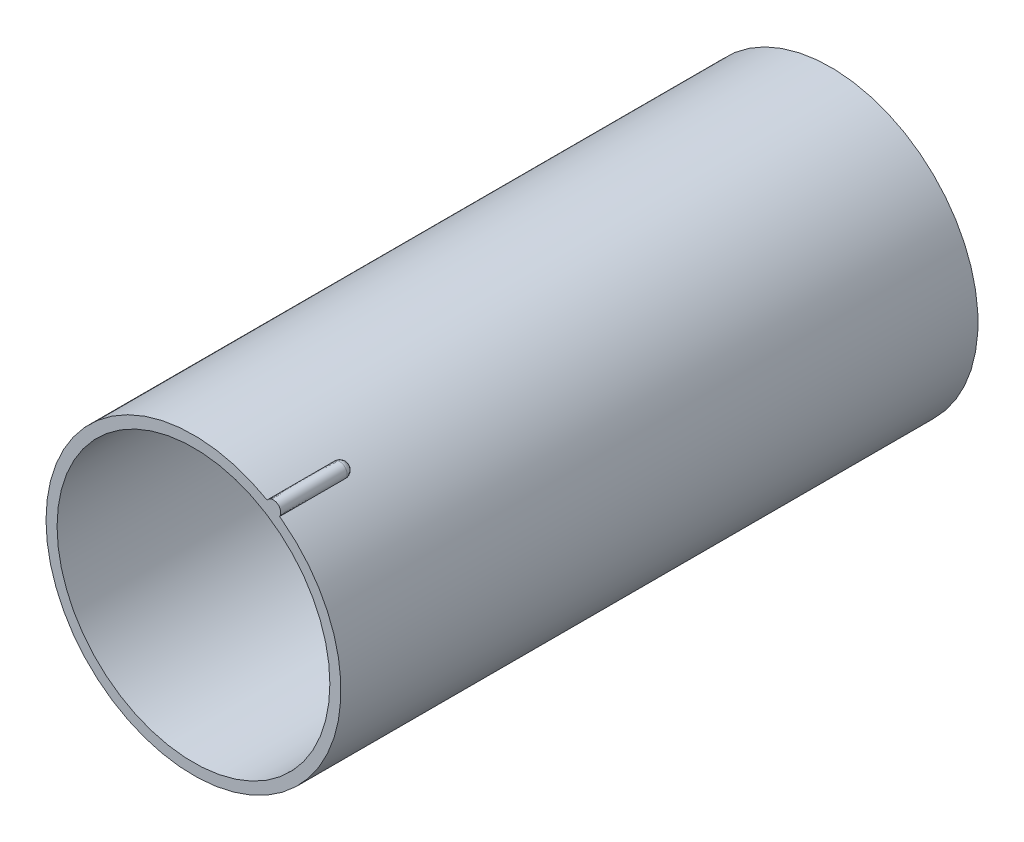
SolidWorks part; units mm, degrees
ref_plane "Спереди" through (0, 0, 0) normal (0, 0, 1) x (1, 0, 0)
ref_plane "Сверху" through (0, 0, 0) normal (0, 1, 0) x (1, 0, 0)
ref_plane "Справа" through (0, 0, 0) normal (1, 0, 0) x (0, 0, -1)
sketch "Эскиз2" plane through (0, 0, 0) normal (0, 0, 1) x (1, 0, 0)
  circle A0 centre (0, 0) radius 20
  circle A1 centre (0, 0) radius 18.5
  dimension "D1" = 40
  dimension "D2" = 37
extrude "Бобышка-Вытянуть1" add sketch "Эскиз2" along normal blind 86.4
sketch "Эскиз5" plane through (0, 0, 0) normal (0, 0, -1) x (-1, 0, 0)
  line L0 (0, 0) -> (0, 18.5) construction
  line L1 (0, 0) -> (2.9901, 18.2568) construction
  line L2 (0, 18.5) -> (0, 9.2195)
  line L3 (2.9901, 18.2568) -> (1.4901, 9.0983)
  circle A0 centre (0, 0) radius 18.5 construction
  arc A1 (0, 18.5) -> (2.9901, 18.2568) centre (0, 0) cw
  arc A2 (1.4901, 9.0983) -> (3.3687, 3.6948) centre (7.4112, 8.1286) ccw
  circle A3 centre (0, 0) radius 3
  arc A4 (-2.7273, 4.1907) -> (3.3687, 3.6948) centre (0, 0) ccw
  arc A5 (0, 9.2195) -> (-2.7273, 4.1907) centre (-6, 9.2195) cw
  point P16 (0, 5)
  dimension "D2" = 5
  dimension "D3" = 6
  dimension "D4" = 6
  dimension "D1" = 3
extrude "Бобышка-Вытянуть3" add sketch "Эскиз5" against normal through all
sketch "Sketch1" plane through (0, 0, 0) normal (0, 0, -1) x (-1, 0, 0)
  circle A0 centre (0, 0) radius 18.5
  arc A1 (0, 18.5) -> (2.9901, 18.2568) centre (0, 0) ccw construction
extrude "Cut-Extrude1" cut sketch "Sketch1" against normal blind 49
sketch "Sketch2" plane through (0, 0, 86.4) normal (0, 0, 1) x (1, 0, 0)
  circle A0 centre (0, 0) radius 18.5
  arc A1 (-2.9901, 18.2568) -> (0, 18.5) centre (0, 0) ccw construction
extrude "Cut-Extrude2" cut sketch "Sketch2" against normal blind 29
sketch "Sketch4" plane through (0, 0, 86.4) normal (0, 0, 1) x (1, 0, 0)
  line L0 (0, 0) -> (0, 18.5) construction
  line L1 (0, 18.5) -> (9.25, 16.0215) construction
  line L2 (9.25, 16.0215) -> (0, 0) construction
  line L3 (9.25, 16.0215) -> (10, 17.3205) construction
  line L4 (10, 17.3205) -> (11.6799, 16.2352)
  circle A0 centre (0, 0) radius 18.5 construction
  circle A1 centre (0, 0) radius 20 construction
  arc A2 (10, 17.3205) -> (11.6799, 16.2352) centre (10.8399, 16.7778) cw
  dimension "D2" = 1
  dimension "D1" = 30
  dimension "D3" = 2
extrude "Boss-Extrude2" add sketch "Sketch4" against normal blind 10
fillet "Fillet1" radius 1 1 edges at (11.3826, 17.6178, 76.4)
